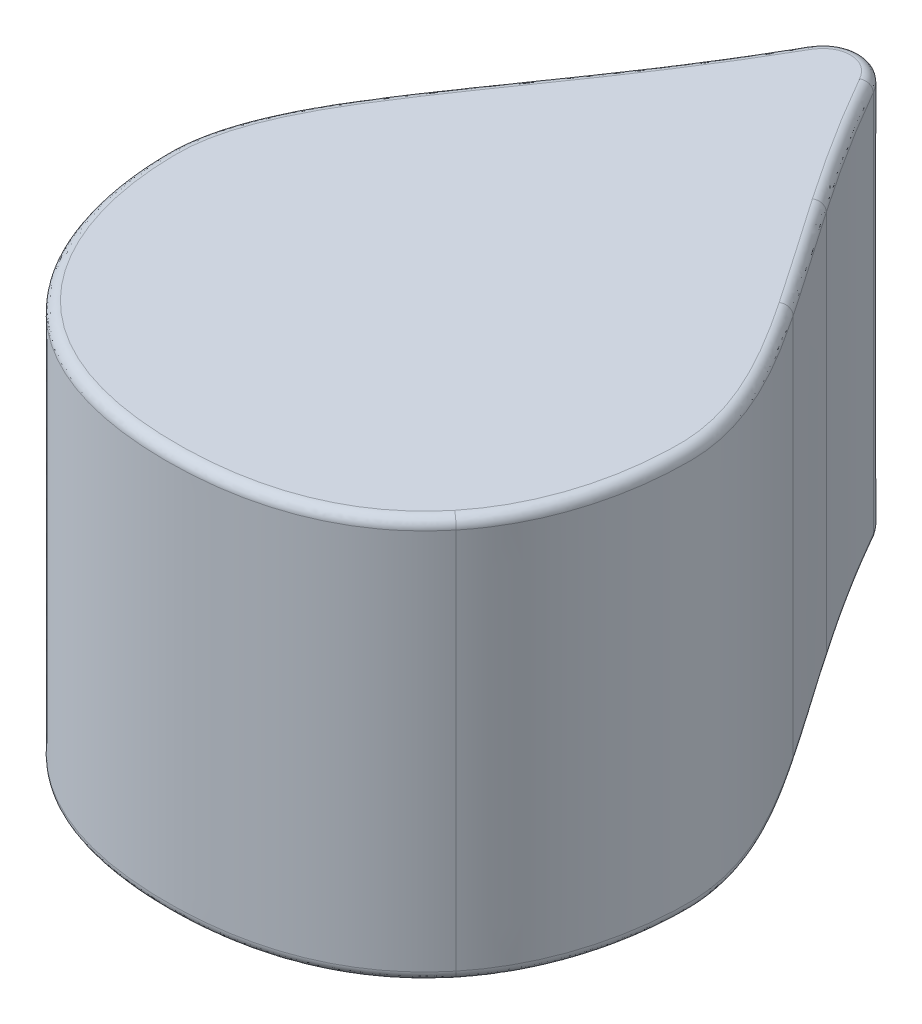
SolidWorks part; units mm, degrees
ref_plane "Front Plane" through (0, 0, 0) normal (0, 0, 1) x (1, 0, 0)
ref_plane "Top Plane" through (0, 0, 0) normal (0, 1, 0) x (1, 0, 0)
ref_plane "Right Plane" through (0, 0, 0) normal (1, 0, 0) x (0, 0, -1)
body saved out of another part "Stock-Wooden Clock Video-1"
fillet "Fillet1" radius 0.5 14 edges
